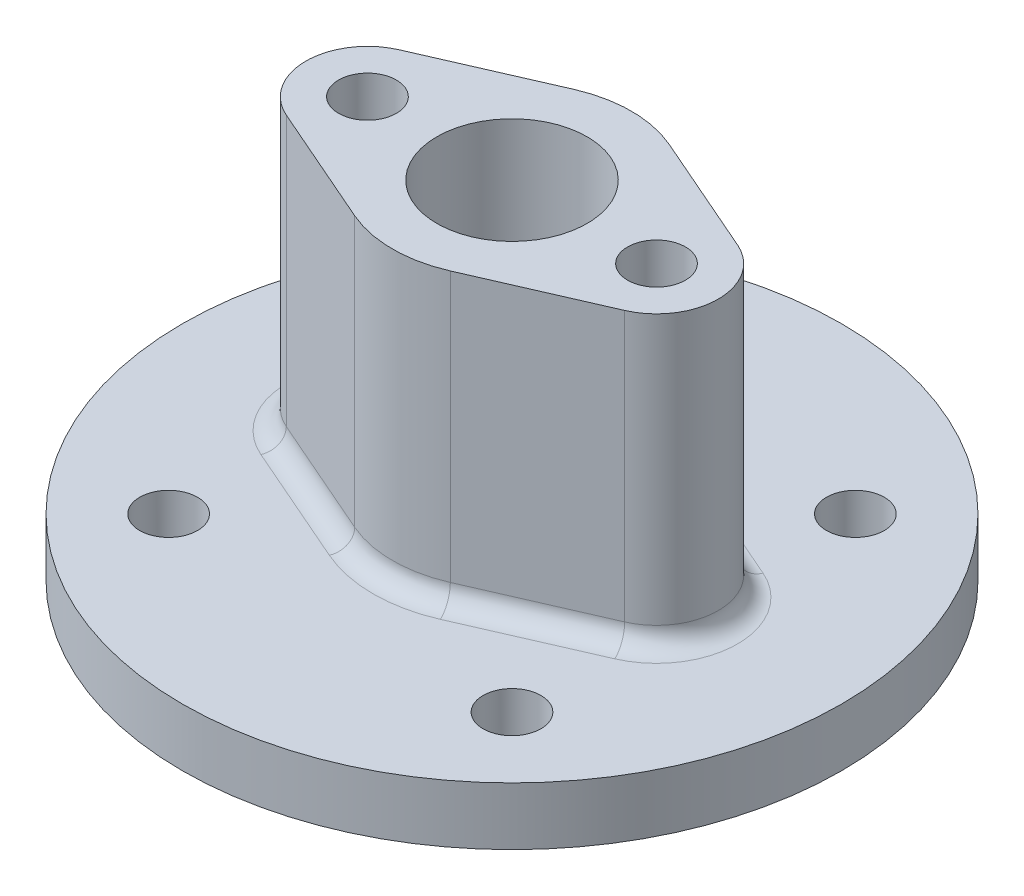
SolidWorks part; units mm, degrees
ref_plane "Front" through (0, 0, 0) normal (0, 0, 1) x (1, 0, 0)
ref_plane "Top" through (0, 0, 0) normal (0, 1, 0) x (1, 0, 0)
ref_plane "Right" through (0, 0, 0) normal (1, 0, 0) x (0, 0, -1)
sketch "Sketch1" plane through (0, 0, 0) normal (0, 0, 1) x (1, 0, 0)
  line L0 (0, 0) -> (85.5, 0)
  line L1 (85.5, 0) -> (85.5, -15)
  line L2 (85.5, -15) -> (42, -15)
  line L3 (42, -15) -> (24, -57)
  line L4 (24, -57) -> (0, -57)
  line L5 (0, -57) -> (0, 0)
  line L6 (0, 41.7043) -> (0, -91.0762) construction
  dimension "D1" = 171
  dimension "D2" = 15
  dimension "D3" = 84
  dimension "D4" = 48
  dimension "D5" = 42
revolve "Revolve1" add sketch "Sketch1" angle 360 about L6
sketch "Sketch2" plane through (0, 0, 0) normal (0, 1, 0) x (-1, 0, 0)
  line L0 (0, -49.5385) -> (0, 52.501) construction
  line L1 (-43.9, -14.6642) -> (-12.4, -28.412)
  line L2 (43.9, -14.6642) -> (12.4, -28.412)
  line L3 (-43.9, 14.6642) -> (-12.4, 28.412)
  line L4 (43.9, 14.6642) -> (12.4, 28.412)
  arc A0 (12.4, 28.412) -> (-12.4, 28.412) centre (0, 0) ccw
  arc A1 (-43.9, 14.6642) -> (-43.9, -14.6642) centre (-37.5, 0) ccw
  arc A2 (43.9, 14.6642) -> (43.9, -14.6642) centre (37.5, 0) cw
  arc A3 (-12.4, -28.412) -> (12.4, -28.412) centre (0, 0) ccw
  dimension "D1" = 31
  dimension "D2" = 16
  dimension "D3" = 75
extrude "Extrude1" add sketch "Sketch2" along normal blind 75
sketch "Sketch3" plane through (0, 0, 0) normal (0, 0, 1) x (1, 0, 0)
  line L0 (0, 80.5997) -> (0, -67.6867) construction
  line L1 (19.5, 75) -> (19.5, 45)
  line L2 (12.4, 75) -> (43.9, 75) construction
  line L3 (19.5, 45) -> (10.5, 43)
  line L4 (10.5, 43) -> (10.5, 33)
  line L5 (10.5, 33) -> (19.5, 33)
  line L6 (19.5, 33) -> (19.5, 9)
  line L7 (19.5, 9) -> (10.5, 9)
  line L8 (10.5, 9) -> (10.5, -57)
  line L9 (-24, -57) -> (24, -57) construction
  line L10 (10.5, -57) -> (0, -57)
  line L11 (0, -57) -> (0, 75)
  line L12 (0, 75) -> (19.5, 75)
  dimension "D1" = 30
  dimension "D2" = 2
  dimension "D3" = 10
  dimension "D4" = 24
  dimension "D5" = 39
  dimension "D6" = 21
  dimension "D7" = 21
revolve "Cut-Revolve1" cut sketch "Sketch3" angle 360 about L0
sketch "Sketch4" plane through (0, 0, 0) normal (0, 1, 0) x (-1, 0, 0)
  line L0 (0, 0) -> (-63, 0) construction
  circle A0 centre (0, 0) radius 63 construction
  point P4 (-44.5477, -44.5477)
  dimension "D1" = 126
  dimension "D2" = 45
other "Hole1"
sketch "Sketch5" plane through (0, 0, 0) normal (0, 1, 0) x (-1, 0, 0)
  circle A0 centre (-44.5477, -44.5477) radius 7.5
  dimension "D1" = 15
pattern_circular "CirPattern1" count 4 over 360 about axis through (0, 0, 0) along (0, 1, 0) of "Hole1"
hole_wizard "M15.0 (15.000000) Diameter Hole1" positions "Sketch7" profile "Sketch6" hole size "M15.0" standard "Ansi Metric"
sketch "Sketch7" plane through (0, 75, 0) normal (0, 1, 0) x (-1, 0, 0)
  arc A0 (43.9, -14.6642) -> (43.9, 14.6642) centre (37.5, 0) ccw construction
  point P0 (37.5, 0)
sketch "Sketch6" plane through (-37.5, 75, 0) normal (1, 0, 0) x (0, 0, 1)
  line L0 (0, 0) -> (0, 29.5065)
  line L1 (0, 29.5065) -> (7.5, 25)
  line L2 (7.5, 25) -> (7.5, 0)
  line L5 (7.5, 0) -> (0, 0)
  line L10 (0, 29.5065) -> (-7.5, 25) construction
  line L11 (0, -6.35) -> (0, 107.95) construction
  dimension "Hole Dia." = 15
  dimension "Hole Depth" = 25
  dimension "Drill Angle" = 118
mirror "Mirror1" about plane through (0, 0, 0) normal (1, 0, 0) of "M15.0 (15.000000) Diameter Hole1"
fillet "Fillet1" radius 5 8 edges at (-53.5, 0, 0) (-28.15, 0, -21.5381) (0, 0, -31) (28.15, 0, -21.5381) (53.5, 0, 0) (28.15, 0, 21.5381) (0, 0, 31) (-28.15, 0, 21.5381)
